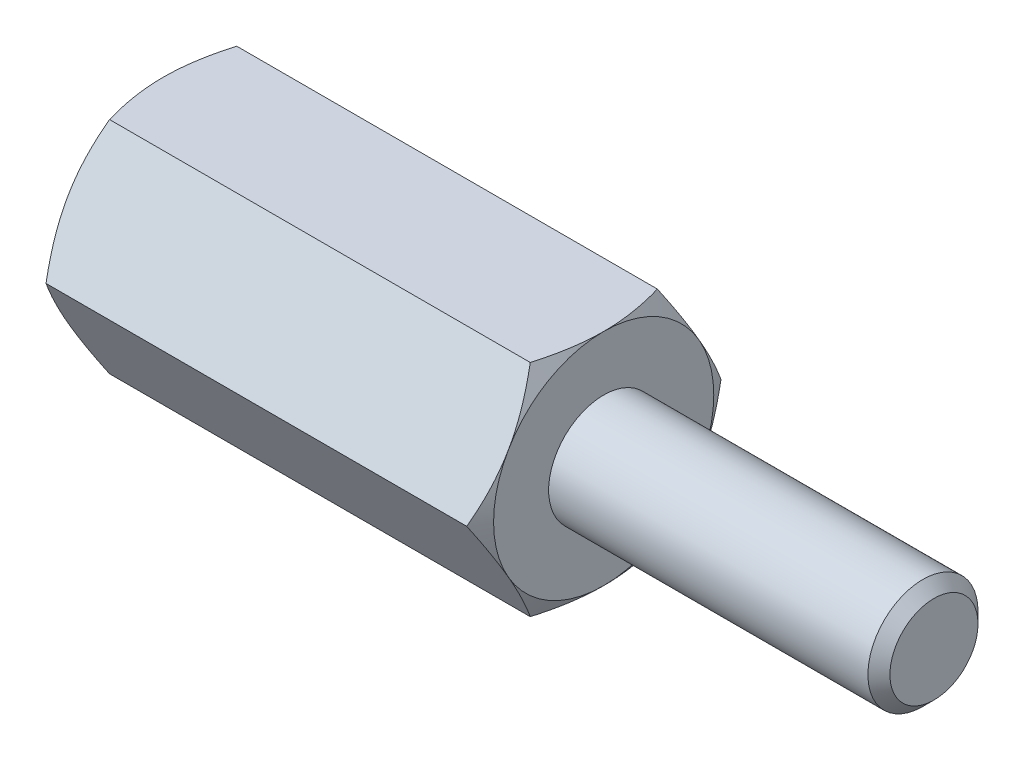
SolidWorks part; units mm, degrees
ref_plane "Front Plane" through (0, 0, 0) normal (0, 0, 1) x (1, 0, 0)
ref_plane "Top Plane" through (0, 0, 0) normal (0, 1, 0) x (1, 0, 0)
ref_plane "Right Plane" through (0, 0, 0) normal (1, 0, 0) x (0, 0, -1)
sketch "Sketch1" plane through (0, 0, 0) normal (1, 0, 0) x (0, 0, -1)
  line L1 (1.1547, 2) -> (-1.1547, 2)
  line L2 (-1.1547, 2) -> (-2.3094, 0)
  line L3 (-2.3094, 0) -> (-1.1547, -2)
  line L4 (-1.1547, -2) -> (1.1547, -2)
  line L5 (1.1547, -2) -> (2.3094, 0)
  line L6 (2.3094, 0) -> (1.1547, 2)
  circle A0 centre (0, 0) radius 2 construction
  dimension "D1" = 4
extrude "Extrude2" add sketch "Sketch1" along normal mid plane 8
sketch "Sketch2" plane through (0, 0, 0) normal (0, 0, 1) x (1, 0, 0)
  line L0 (-4, 2) -> (-2.5, 4.5981)
  line L1 (-4, 5) -> (-4, 2)
  line L3 (0, 0) -> (50000, 0) construction
  arc A0 (-2.5, 4.5981) -> (-4, 5) centre (-3.1962, 5) ccw
  dimension "D1" = 30
  dimension "D2" = 3
revolve "Cut-Revolve1" cut sketch "Sketch2" angle 360 about L3
mirror "Mirror1" about plane through (0, 0, 0) normal (1, 0, 0) of "Cut-Revolve1"
sketch "Sketch3" plane through (-4, 0, 0) normal (-1, 0, 0) x (0, 0, 1)
  circle A0 centre (0, 0) radius 0.8
  dimension "D1" = 1.6
extrude "Extrude3" cut sketch "Sketch3" against normal blind 5
sketch "Sketch4" plane through (0, 0, 0) normal (0, 0, 1) x (1, 0, 0)
  line L0 (1, 0) -> (1, 0.8)
  line L1 (3.8214, 0) -> (-3.8214, 0) construction
  line L2 (1, 0.8) -> (1.4619, 0)
  line L3 (1.4619, 0) -> (1, 0)
  line L4 (-4, 1) -> (-4, -1) construction
  point P4 (-4, 0)
  dimension "D1" = 30
  dimension "D2" = 0.8
  dimension "D3" = 5
revolve "Cut-Revolve2" cut sketch "Sketch4" angle 360 about L3
sketch "Sketch5" plane through (4, 0, 0) normal (1, 0, 0) x (0, 0, -1)
  circle A0 centre (0, 0) radius 1
  dimension "D1" = 2
extrude "Extrude4" add sketch "Sketch5" along normal blind 6
chamfer "Chamfer1" distance 0.2 angle 45 1 edges at (10, 0, -1)
equation "\"D2@Sketch4\" = \"D1@Sketch3\"/2"
